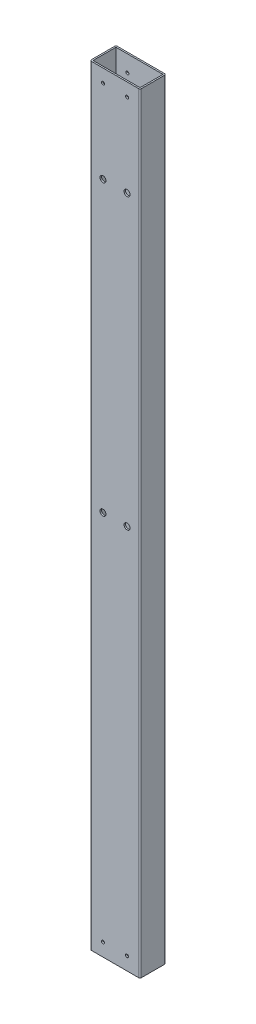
SolidWorks part; units mm, degrees
ref_plane "Front Plane" through (0, 0, 0) normal (0, 0, 1) x (1, 0, 0)
ref_plane "Top Plane" through (0, 0, 0) normal (0, 1, 0) x (1, 0, 0)
ref_plane "Right Plane" through (0, 0, 0) normal (1, 0, 0) x (0, 0, -1)
sketch "Sketch1" plane through (0, 0, 0) normal (0, 1, 0) x (1, 0, 0)
  line L1 (-24.8285, -13.716) -> (24.8285, -13.716)
  line L2 (-26.416, -12.1285) -> (-26.416, 12.1285)
  line L3 (-24.8285, 13.716) -> (24.8285, 13.716)
  line L4 (26.416, -12.1285) -> (26.416, 12.1285)
  line L5 (-26.416, -13.716) -> (26.416, 13.716) construction
  line L6 (-26.416, 13.716) -> (26.416, -13.716) construction
  arc A0 (-24.8285, -13.716) -> (-26.416, -12.1285) centre (-24.8285, -12.1285) cw
  arc A1 (24.8285, -13.716) -> (26.416, -12.1285) centre (24.8285, -12.1285) ccw
  arc A2 (24.8285, 13.716) -> (26.416, 12.1285) centre (24.8285, 12.1285) cw
  arc A3 (-26.416, 12.1285) -> (-24.8285, 13.716) centre (-24.8285, 12.1285) cw
  point P0 (0, 0)
  dimension "D3" = 1.5875
  dimension "D1" = 52.832
  dimension "D2" = 27.432
extrude "Extrude-Thin1" add sketch "Sketch1" along normal mid plane 812.8 thin
sketch "Sketch2" plane through (0, 0, 13.716) normal (0, 0, 1) x (1, 0, 0)
  line L0 (-12.7, 0) -> (12.7, 0) construction
  line L1 (-12.7, 304.8) -> (12.7, 304.8) construction
  line L3 (-24.8285, 406.4) -> (24.8285, 406.4) construction
  circle A0 centre (-12.7, 0) radius 3.175
  circle A1 centre (12.7, 0) radius 3.175
  circle A2 centre (-12.7, 304.8) radius 3.175
  circle A3 centre (12.7, 304.8) radius 3.175
  point P4 (0, 0)
  point P10 (0, 304.8)
  dimension "D1" = 6.35
  dimension "D2" = 25.4
  dimension "D3" = 25.4
  dimension "D4" = 101.6
extrude "Cut-Extrude1" cut sketch "Sketch2" against normal through all
sketch "Sketch3" plane through (0, 0, 0) normal (0, 0, 1) x (1, 0, 0)
  line L0 (-24.8285, 406.4) -> (24.8285, 406.4) construction
  line L3 (-12.7, 392.557) -> (12.7, 392.557) construction
  line L4 (-24.8285, -406.4) -> (24.8285, -406.4) construction
  circle A0 centre (-12.7, 392.557) radius 1.5875
  circle A2 centre (12.7, 392.557) radius 1.5875
  circle A3 centre (12.7, -392.557) radius 1.5875
  circle A4 centre (-12.7, -392.557) radius 1.5875
  point P2 (0, 406.4)
  point P11 (0, 392.557)
  dimension "D1" = 2
  dimension "D3" = 3.175
  dimension "D4" = 13.843
  dimension "D5" = 25.4
  dimension "D6" = 13.843
  dimension "D2" = 2
extrude "Cut-Extrude2" cut sketch "Sketch3" along normal through all
sketch "Sketch4" plane through (0, 0, 0) normal (0, 0, 1) x (1, 0, 0)
  line L0 (12.7, -388.9375) -> (12.7, -392.557) construction
  circle A0 centre (12.7, -388.9375) radius 1.5875
  circle A1 centre (-12.7, -388.9375) radius 1.5875
  circle A2 centre (-12.7, 388.9375) radius 1.5875
  circle A3 centre (12.7, 388.9375) radius 1.5875
  circle A4 centre (12.7, -392.557) radius 1.5875 construction
  circle A5 centre (12.7, 392.557) radius 1.5875 construction
  dimension "D1" = 2
  dimension "D3" = 3.6195
  dimension "D4" = 3.6195
  dimension "D2" = 2
extrude "Cut-Extrude3" cut sketch "Sketch4" against normal through all
